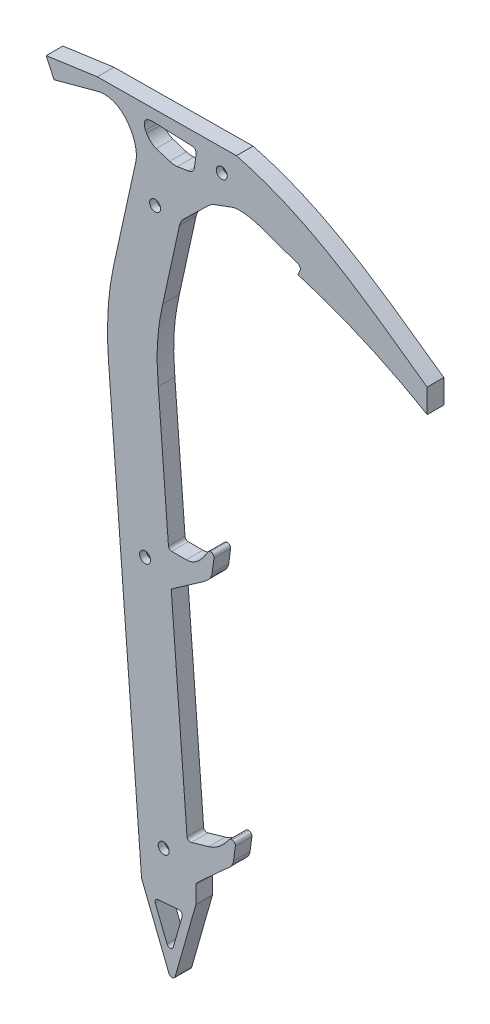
SolidWorks part; units mm, degrees
ref_plane "Front Plane" through (0, 0, 0) normal (0, 0, 1) x (1, 0, 0)
ref_plane "Top Plane" through (0, 0, 0) normal (0, 1, 0) x (1, 0, 0)
ref_plane "Right Plane" through (0, 0, 0) normal (1, 0, 0) x (0, 0, -1)
other "Bounding Box"
ref_plane "Default Plane" through (-85.2228, 232.448, 0) normal (0.9878, 0.1558, 0) x (0, 0, -1)
sketch "Sketch2" plane through (0, 0, 0) normal (0, 0, 1) x (1, 0, 0)
  line L0 (31.0095, -409.0266) -> (50.3129, 200.2677) construction
  line L1 (44.6721, -347.3042) -> (13.607, 57.9067) construction
  line L2 (6.6836, -350.2166) -> (44.6721, -347.3042) construction
  line L3 (-24.3815, 54.9944) -> (6.6836, -350.2166)
  line L4 (33.3675, 188.6776) -> (17.033, 114.249)
  line L5 (-3.5959, 197.9884) -> (-20.611, 120.4586)
  line L6 (-33.0001, 230.1938) -> (-66.1198, 221.2764)
  line L7 (-78.5559, 217.928) -> (-85.2148, 232.4492) construction
  line L8 (-33.0001, 239.7742) -> (73.4154, 240.7486)
  line L9 (-72.0877, 234.2908) -> (-33.0001, 239.7742)
  line L10 (38.1922, 193.0982) -> (70.0858, 204.9113)
  line L11 (219.3152, 142.1325) -> (219.3152, 160.4223)
  line L12 (219.3152, 142.1325) -> (120.4435, 185.4637) construction
  line L13 (120.4435, 185.4637) -> (123.1802, 191.7081)
  line L14 (123.1802, 191.7081) -> (90.0064, 203.3731)
  line L15 (9.9641, 231.3514) -> (39.2147, 230.1938)
  line L16 (3.9087, 222.8328) -> (10.3233, 210.1062)
  line L17 (42.6016, 226.4763) -> (41.2161, 216.4695)
  line L18 (14.0181, 208.772) -> (36.5462, 212.2102)
  line L19 (27.4053, -122.0771) -> (13.607, 57.9067)
  line L20 (48.1647, -347.0365) -> (30.3446, -409.6333)
  line L21 (30.3446, -409.6333) -> (6.6836, -350.2166)
  line L22 (27.4053, -122.0771) -> (40.9199, -122.0771)
  line L23 (62.4635, -107.5319) -> (60.6474, -121.0144)
  line L24 (29.3333, -147.226) -> (52.7557, -130.9017)
  line L25 (62.4635, -107.5319) -> (58.0169, -107.5319)
  line L26 (29.3333, -147.226) -> (41.6789, -308.2607)
  line L27 (25.6779, -348.7604) -> (30.3446, -409.6333) construction
  line L28 (15.9069, -358.2248) -> (38.6961, -356.4777)
  line L29 (15.9069, -358.2248) -> (28.906, -390.8676)
  line L30 (28.906, -390.8676) -> (38.6961, -356.4777)
  line L31 (-72.0877, 234.2908) -> (-66.1198, 221.2764)
  line L32 (48.1647, -332.6989) -> (48.1647, -347.0365)
  line L33 (-85.2148, 232.4492) -> (-72.0877, 234.2908) construction
  line L34 (41.6789, -308.2607) -> (58.0169, -303.5819)
  line L35 (78.7824, -290.1774) -> (76.9664, -303.6598)
  line L36 (48.1647, -332.6989) -> (69.0747, -313.5472)
  line L37 (78.7824, -290.1774) -> (74.3358, -290.1774)
  line L38 (-66.1198, 221.2764) -> (-78.5559, 217.928) construction
  spline S0 degree 3 poles (-24.3815, 54.9944) (-26.1546, 78.1223) (-25.1036, 99.9878) (-20.611, 120.4586) knots 0 0 0 0 1 1 1 1
  spline S1 degree 3 poles (17.033, 114.249) (11.9648, 91.1558) (12.1688, 76.6671) (13.607, 57.9067) knots 0 0 0 0 1 1 1 1
  spline S2 degree 3 poles (-33.0001, 230.1938) (-27.1367, 231.7726) (-14.9868, 229.4205) (-4.2882, 214.5639) (-2.5291, 202.8493) (-3.5959, 197.9884) knots 0 0 0 0 0.318927 0.707776 1 1 1 1
  spline S3 degree 3 poles (33.3675, 188.6776) (33.8997, 191.1028) (36.1468, 192.3406) (38.1922, 193.0982) knots 0 0 0 0 1 1 1 1
  spline S4 degree 3 poles (219.3152, 160.4223) (171.7359, 194.0829) (130.1784, 225.9646) (73.4154, 240.7486) knots 0 0 0 0 1 1 1 1
  spline S5 degree 2 poles (219.3152, 142.1325) (171.6775, 170.1277) (120.4435, 185.4637) knots 0 0 0 1 1 1
  spline S6 degree 3 poles (70.0858, 204.9113) (74.2686, 206.4606) (83.7236, 205.5824) (90.0064, 203.3731) knots 0 0 0 0 1 1 1 1
  spline S7 degree 3 poles (3.9087, 222.8328) (2.3406, 225.9438) (1.8537, 231.6724) (9.9641, 231.3514) knots 0 0 0 0 1 1 1 1
  spline S8 degree 3 poles (39.2147, 230.1938) (41.862, 230.0891) (42.8331, 228.1483) (42.6016, 226.4763) knots 0 0 0 0 1 1 1 1
  spline S9 degree 3 poles (10.3233, 210.1062) (10.9127, 208.9369) (12.1452, 208.4861) (14.0181, 208.772) knots 0 0 0 0 1 1 1 1
  spline S10 degree 3 poles (36.5462, 212.2102) (39.4356, 212.6512) (40.9271, 214.3826) (41.2161, 216.4695) knots 0 0 0 0 1 1 1 1
  spline S11 degree 2 poles (58.0169, -107.5319) (50.1965, -122.0771) (40.9199, -122.0771) knots 0 0 0 1 1 1
  spline S12 degree 3 poles (60.6474, -121.0144) (60.0315, -125.5867) (56.2153, -128.4905) (52.7557, -130.9017) knots 0 0 0 0 1 1 1 1
  spline S15 degree 2 poles (74.3358, -290.1774) (66.935, -301.028) (58.0169, -303.5819) knots 0 0 0 1 1 1
  spline S16 degree 3 poles (76.9664, -303.6598) (76.3505, -308.2322) (72.1843, -310.699) (69.0747, -313.5472) knots 0 0 0 0 1 1 1 1
  dimension "D1" = 609.6
  dimension "D2" = 38.1
  dimension "D3" = 406.4
  dimension "D4" = 406.4
  dimension "D5" = 76.2
  dimension "D6" = 79.375
  dimension "D7" = 38.1
  dimension "D8" = 107.95
  dimension "D9" = 18.2898
  dimension "D10" = 12.7
extrude "Boss-Extrude1" add sketch "Sketch2" along normal blind 12.7
fillet "Fillet1" radius 2.54 15 edges at (123.1802, 191.7081, 6.35) (-33.0001, 239.7742, 6.35) (6.6836, -350.2166, 6.35) (30.3446, -409.6333, 6.35) (48.1647, -347.0365, 6.35) (48.1647, -332.6989, 6.35) (41.6789, -308.2607, 6.35) (74.3358, -290.1774, 6.35) (78.7824, -290.1774, 6.35) (27.4053, -122.0771, 6.35) (58.0169, -107.5319, 6.35) (62.4635, -107.5319, 6.35) (28.906, -390.8676, 6.35) (15.9069, -358.2248, 6.35) (38.6961, -356.4777, 6.35)
sketch "Sketch7" plane through (0, 0, 12.7) normal (0, 0, 1) x (1, 0, 0)
  line L0 (-15.951, -54.9727) -> (-21.7757, 21.0043)
  line L1 (-15.951, -54.9727) -> (22.0375, -52.0604)
  line L2 (-21.7757, 21.0043) -> (16.2128, 23.9167)
  line L3 (22.0375, -52.0604) -> (16.2128, 23.9167)
  line L4 (-24.3815, 54.9944) -> (6.654, -349.8306) construction
  line L6 (35.0607, -356.7564) -> (19.3502, -357.9608) construction
  line L7 (27.2255, -119.7313) -> (13.607, 57.9067) construction
  dimension "D1" = 76.2
  dimension "D2" = 304.8
extrude "Cut-Extrude1" cut sketch "Sketch7" against normal through all both and the other way through all
move or copy body "Body-Move/Copy1" bodies to move or copy 110 copy no translate (5.8247, -75.9771, 0)
combine bodies "Combine1" operation type add bodies to combine 105 111
sketch "Sketch8" plane through (0, 0, 0) normal (0, 0, -1) x (-1, 0, 0)
  line L0 (-31.1069, 134.5141) -> (-12.9407, 140.4925)
  line L1 (-19.8428, 132.7949) -> (-42.3709, 136.2332) construction
  line L2 (-9.7334, 146.8558) -> (-16.148, 134.1292) construction
  line L3 (-59.9637, 123.0277) -> (-36.4698, 100.2958)
  line L4 (-44.0169, 117.1211) -> (-75.9105, 128.9343) construction
  line L5 (-22.8577, 38.2719) -> (-39.1922, 112.7006) construction
  line L6 (-12.9407, 140.4925) -> (-16.148, 134.1292)
  line L7 (-19.8428, 132.7949) -> (-31.1069, 134.5141)
  line L8 (-36.4698, 100.2958) -> (-39.1922, 112.7006)
  line L9 (-44.0169, 117.1211) -> (-59.9637, 123.0277)
  spline S0 degree 3 poles (-1484.1796, 1485.4007) (460.001, 60.0598) (405.8009, -749.5395) (-1246.2208, 1709.7648) knots -27.50692 -27.50692 -27.50692 -27.50692 25.241817 25.241817 25.241817 25.241817 only from (-16.148, 134.1292) to (-19.8428, 132.7949) construction
  spline S1 degree 3 poles (-1839.0207, -757.1988) (1871.9811, 864.5832) (-1999.0847, -533.9288) (1868.3496, 702.148) knots -9.000867 -9.000867 -9.000867 -9.000867 10.994632 10.994632 10.994632 10.994632 only from (-39.1922, 112.7006) to (-44.0169, 117.1211) construction
  spline S2 degree 3 poles (-16.148, 134.1292) (-16.7374, 132.9599) (-17.9699, 132.5091) (-19.8428, 132.7949) knots 0 0 0 0 1 1 1 1
  spline S3 degree 3 poles (-39.1922, 112.7006) (-39.7245, 115.1258) (-41.9715, 116.3635) (-44.0169, 117.1211) knots 0 0 0 0 1 1 1 1
  dimension "D1" = 12.7
extrude "Boss-Extrude2" add sketch "Sketch8" against normal up to surface (12.7 mm away)
fillet "Fillet2" radius 12.7 4 edges at (12.9407, 140.4925, 6.35) (31.1069, 134.5141, 6.35) (59.9637, 123.0277, 6.35) (36.4698, 100.2958, 6.35)
sketch "Sketch9" plane through (0, 0, 0) normal (0, 0, -1) x (-1, 0, 0)
  line L0 (-15.4618, -129.1079) -> (-16.4714, -142.2773)
  line L5 (-15.4618, -129.1079) -> (-2.2924, -130.1175)
  line L6 (-16.4714, -142.2773) -> (-3.3021, -143.2869)
  line L7 (-2.2924, -130.1175) -> (-3.3021, -143.2869)
  line L8 (-15.4618, -129.1079) -> (-3.3021, -143.2869) construction
  line L9 (-16.4714, -142.2773) -> (-2.2924, -130.1175) construction
  line L10 (-30.701, -327.8871) -> (-29.6914, -314.7177)
  line L11 (-30.701, -327.8871) -> (-17.5317, -328.8967)
  line L12 (-29.6914, -314.7177) -> (-16.5221, -315.7274)
  line L13 (-17.5317, -328.8967) -> (-16.5221, -315.7274)
  line L14 (-30.701, -327.8871) -> (-16.5221, -315.7274) construction
  line L15 (-29.6914, -314.7177) -> (-17.5317, -328.8967) construction
  line L16 (-22.0764, 92.772) -> (-9.1754, 95.6034)
  line L17 (-22.0764, 92.772) -> (-24.9077, 105.673)
  line L18 (-9.1754, 95.6034) -> (-12.0067, 108.5043)
  line L19 (-24.9077, 105.673) -> (-12.0067, 108.5043)
  line L20 (-22.0764, 92.772) -> (-12.0067, 108.5043) construction
  line L21 (-9.1754, 95.6034) -> (-24.9077, 105.673) construction
  line L22 (-74.6132, 141.1377) -> (-61.4052, 141.1377)
  line L23 (-74.6132, 141.1377) -> (-74.6132, 154.3457)
  line L24 (-61.4052, 141.1377) -> (-61.4052, 154.3457)
  line L25 (-74.6132, 154.3457) -> (-61.4052, 154.3457)
  line L26 (-74.6132, 141.1377) -> (-61.4052, 154.3457) construction
  line L27 (-61.4052, 141.1377) -> (-74.6132, 154.3457) construction
  line L28 (-35.6487, 96.5546) -> (1.5656, 104.7218) construction
  line L29 (-28.3762, -134.7412) -> (9.6123, -137.6536) construction
  line L30 (-4.6173, -323.2634) -> (-42.6058, -320.3511) construction
  point P1 (-9.3819, -136.1974)
  point P2 (-23.6115, -321.8072)
  point P3 (-17.0415, 100.6382)
  point P8 (-68.0092, 147.7417)
  dimension "D1" = 13.208
extrude "Cut-Extrude2" cut sketch "Sketch9" against normal blind 7.62
hole_wizard "5/16 Clearance Hole1" positions "Sketch10" profile "Sketch11" hole size "5/16" standard "ANSI Inch"
sketch "Sketch10" plane through (0, 0, 0) normal (0, 0, -1) x (-1, 0, 0)
  line L0 (-28.3762, -134.7412) -> (9.6123, -137.6536) construction
  point P0 (-68.0092, 147.7417)
  point P3 (-17.0415, 100.6382)
  point P6 (-9.3819, -136.1974)
  point P10 (-23.6115, -321.8072)
sketch "Sketch11" plane through (68.0092, 147.7417, 0) normal (1, 0, 0) x (0, 1, 0)
  line L0 (0, 0) -> (0, 12.7)
  line L1 (0, 12.7) -> (4.2164, 12.7)
  line L2 (4.2164, 12.7) -> (4.2164, 0)
  line L5 (4.2164, 0) -> (0, 0)
  line L11 (0, -6.35) -> (0, 107.95) construction
  dimension "Thru Hole Dia." = 8.4328
  dimension "Thru Hole Depth" = 12.7
